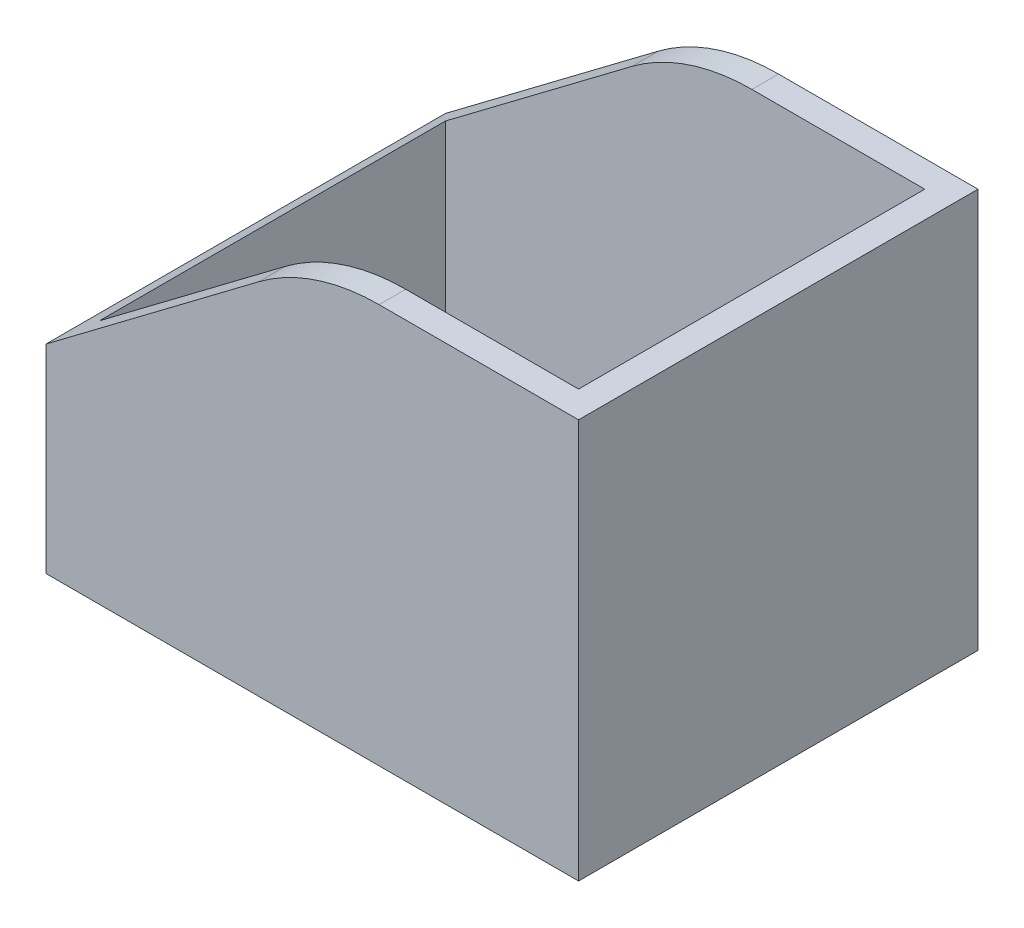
SolidWorks part; units mm, degrees
ref_plane "Plan de face" through (0, 0, 0) normal (0, 0, 1) x (1, 0, 0)
ref_plane "Plan de dessus" through (0, 0, 0) normal (0, 1, 0) x (1, 0, 0)
ref_plane "Plan de droite" through (0, 0, 0) normal (1, 0, 0) x (0, 0, -1)
sketch "Esquisse1" plane through (0, 0, 0) normal (0, 0, 1) x (1, 0, 0)
  line L1 (0, 0) -> (80, 0)
  line L2 (0, 0) -> (0, 60)
  line L3 (0, 60) -> (80, 60)
  line L4 (80, 0) -> (80, 60)
  dimension "D1" = 80
  dimension "D2" = 60
extrude "Boss.-Extru.1" add sketch "Esquisse1" along normal blind 60
chamfer "Chanfrein1" distance 40 angle 37 1 edges at (0, 60, 30)
shell "Coque1" thickness 4
fillet "Congé1" radius 30 2 edges at (40, 60, 58) (40, 60, 2)
